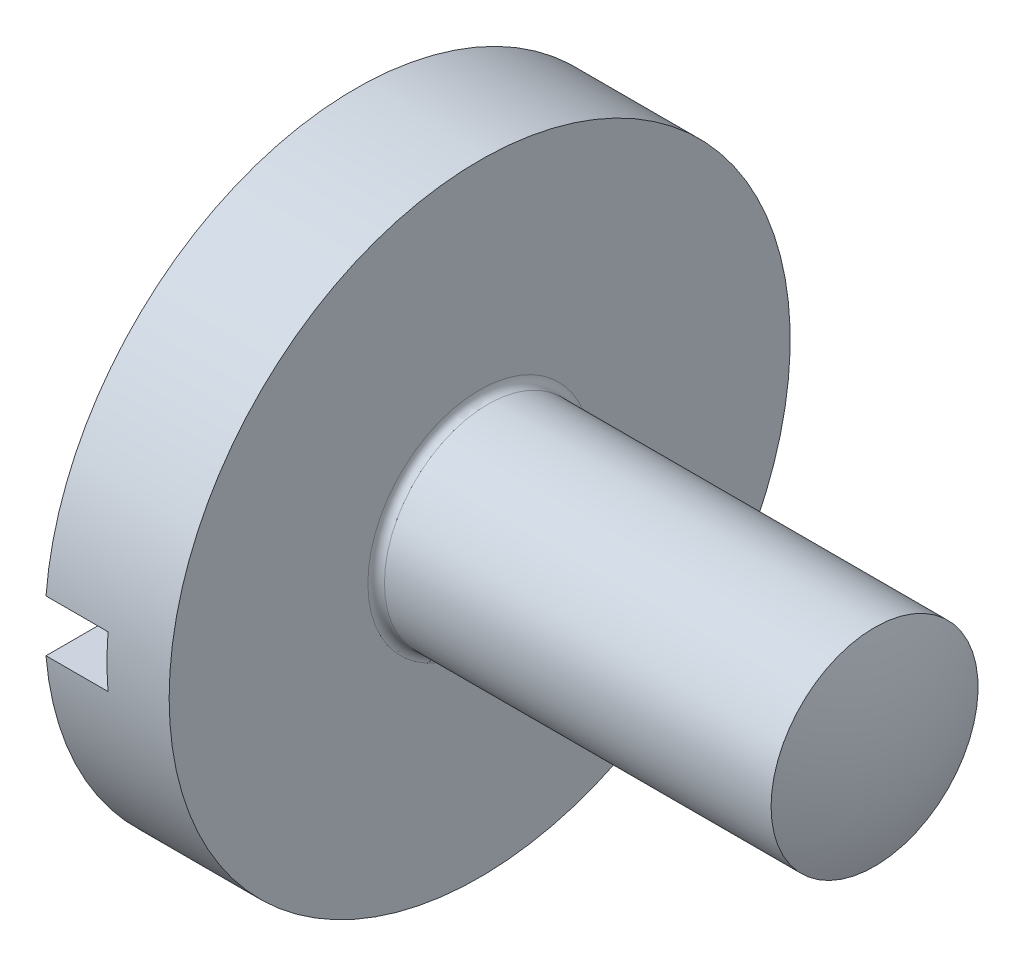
SolidWorks part; units mm, degrees
ref_plane "Front" through (0, 0, 0) normal (0, 0, 1) x (1, 0, 0)
ref_plane "Top" through (0, 0, 0) normal (0, 1, 0) x (1, 0, 0)
ref_plane "Right" through (0, 0, 0) normal (1, 0, 0) x (0, 0, -1)
sketch "Sketch1" plane through (0, 0, 0) normal (0, 0, 1) x (1, 0, 0)
  line L0 (0, 0) -> (0, 15)
  line L1 (0, 15) -> (6, 15)
  line L2 (6, 15) -> (6, 5.4)
  line L3 (6.4, 5) -> (25.0767, 5)
  line L4 (-64.3562, 0) -> (99.7857, 0) construction
  line L5 (0, 0) -> (26, 0)
  line L6 (9, 5) -> (9, 0) construction
  arc A0 (26, 0) -> (25.0767, 5) centre (12, 0) ccw
  arc A1 (6.4, 5) -> (6, 5.4) centre (6.4, 5.4) cw
  dimension "re" = 14
  dimension "r" = 0.4
  dimension "dk" = 30
  dimension "d" = 10
  dimension "k" = 6
  dimension "a" = 3
revolve "Base" add sketch "Sketch1" angle 360 about L4
sketch "Sketch2" plane through (0, 0, 0) normal (0, 0, 1) x (1, 0, 0)
  line L0 (30.8988, 0) -> (-6.4914, 0) construction
  line L1 (0, 1.25) -> (3, 1.25)
  line L2 (0, 1.25) -> (0, -1.25)
  line L3 (0, -1.25) -> (3, -1.25)
  line L4 (3, 1.25) -> (3, -1.25)
  line L7 (0, 15) -> (0, -15) construction
  dimension "n" = 2.5
  dimension "t" = 3
extrude "Slot" cut sketch "Sketch2" against normal through all and the other way through all
sketch "Sketch3" plane through (0, 0, 0) normal (0, 0, 1) x (1, 0, 0)
  line L0 (25.0767, 3.9175) -> (25.7017, 5)
  line L1 (25.7017, 5) -> (25.7017, 6.25)
  line L2 (25.7017, 6.25) -> (24.4517, 6.25)
  line L3 (24.4517, 6.25) -> (24.4517, 5)
  line L4 (24.4517, 5) -> (25.0767, 3.9175)
  line L5 (25.0767, 5) -> (25.0767, -5) construction
  line L6 (0, 0) -> (31.7128, 0) construction
  dimension "D1" = 10
  dimension "D2" = 1.25
revolve "Cut-Revolve10" [suppressed] cut sketch "Sketch3" angle 360 about L6
pattern_linear "LPattern10" [suppressed] count 11 spacing 1.5 along (1, 0, 0)
equation "\"D1@ThreadCosmetic1\" = \"l@Sketch1\" - \"a@Sketch1\""
equation "\"D1@Sketch3\" = \"d@Sketch1\""
equation "\"D2@Sketch3\" =  ( \"d@Sketch1\" - \"THD_MINOR@ThreadCosmetic1\" )  / 2"
equation "\"D3@LPattern10\" = \"D2@Sketch3\" * 1.2"
equation "\"D1@LPattern10\" = \"D1@ThreadCosmetic1\" / \"D3@LPattern10\""
